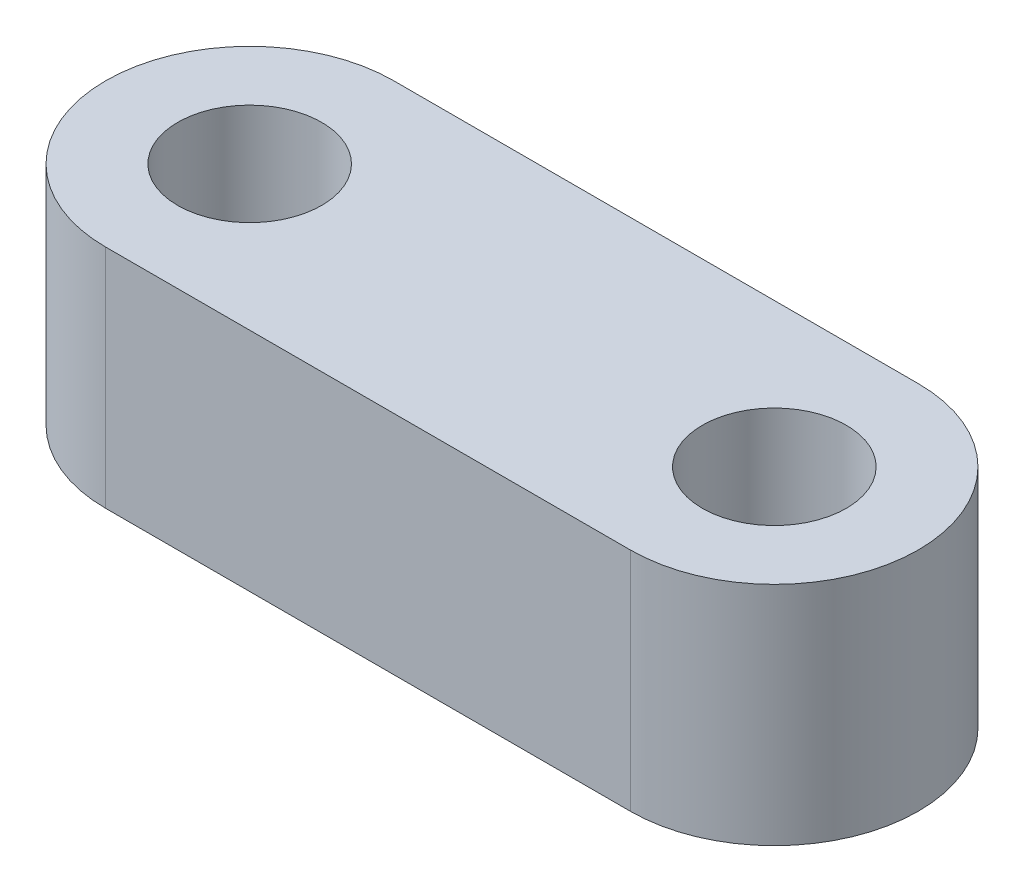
SolidWorks part; units mm, degrees
ref_plane "Front Plane" through (0, 0, 0) normal (0, 0, 1) x (1, 0, 0)
ref_plane "Top Plane" through (0, 0, 0) normal (0, 1, 0) x (1, 0, 0)
ref_plane "Right Plane" through (0, 0, 0) normal (1, 0, 0) x (0, 0, -1)
sketch "Sketch1" plane through (0, 0, 0) normal (0, 1, 0) x (1, 0, 0)
  line L0 (0, 0) -> (-12.75, 0) construction
  line L2 (-12.75, 3.5) -> (0, 3.5)
  line L5 (0, -3.5) -> (-12.75, -3.5)
  arc A0 (-12.75, 3.5) -> (-12.75, -3.5) centre (-12.75, 0) ccw
  arc A1 (0, -3.5) -> (0, 3.5) centre (0, 0) ccw
  circle A2 centre (-12.75, 0) radius 1.75
  circle A3 centre (0, 0) radius 1.75
  dimension "D1" = 12.75
  dimension "D2" = 3.5
  dimension "D3" = 7
  dimension "D4" = 3.5
  dimension "D5" = 7
extrude "Boss-Extrude1" add sketch "Sketch1" along normal blind 5.5
